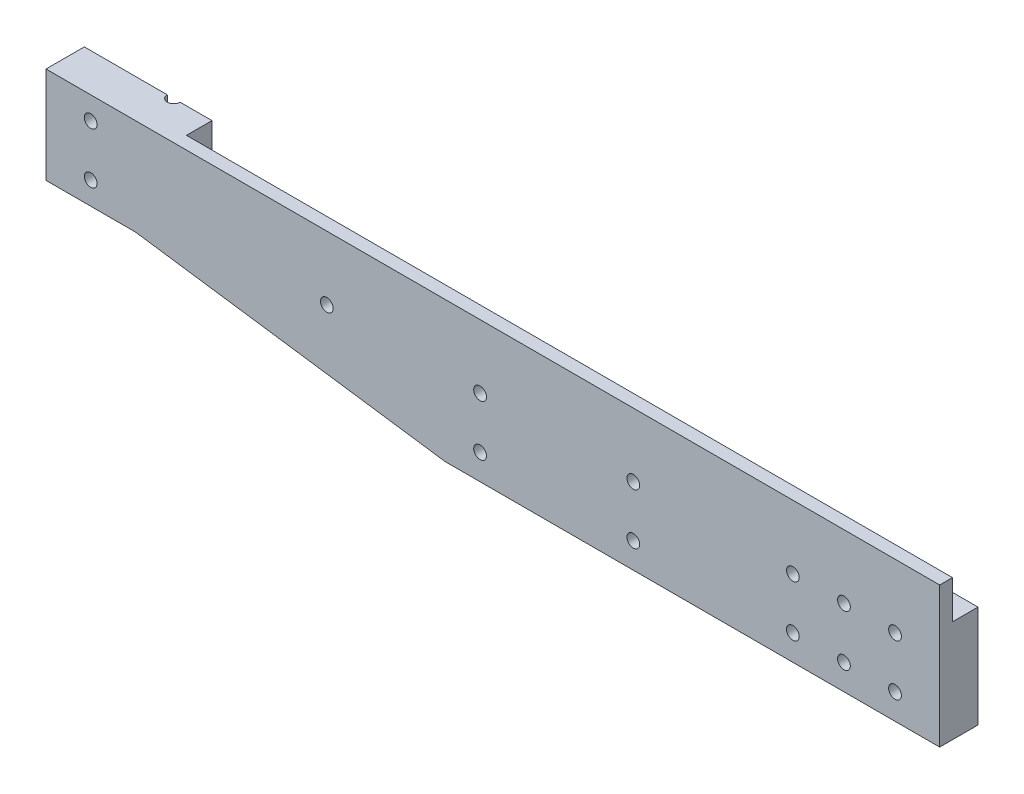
SolidWorks part; units mm, degrees
ref_plane "Front Plane" through (0, 0, 0) normal (0, 0, 1) x (1, 0, 0)
ref_plane "Top Plane" through (0, 0, 0) normal (0, 1, 0) x (1, 0, 0)
ref_plane "Right Plane" through (0, 0, 0) normal (1, 0, 0) x (0, 0, -1)
sketch "Sketch1" plane through (0, 0, 0) normal (0, 1, 0) x (1, 0, 0)
  line L0 (-25.4, 2.54) -> (-111.125, 2.54)
  line L1 (0, 0) -> (-25.4, 0)
  line L2 (0, 0) -> (0, 19.05)
  line L3 (0, 19.05) -> (-25.4, 19.05)
  line L4 (-25.4, 0) -> (-25.4, 2.54)
  line L5 (-111.125, 2.54) -> (-111.125, 0)
  line L6 (-111.125, 0) -> (-492.125, 0)
  line L7 (-25.4, 19.05) -> (-492.125, 19.05)
  line L8 (-492.125, 19.05) -> (-492.125, 0)
  line L9 (-111.125, 0) -> (-25.4, 0)
  dimension "D1" = 19.05
  dimension "D2" = 25.4
  dimension "D3" = 85.725
  dimension "D4" = 381
  dimension "D5" = 2.54
extrude "Boss-Extrude1" add sketch "Sketch1" along normal blind 69.85 contours L7 L8 L6 L5 L0 L4 | L4 L1 L2 L3 | L5 L9 L4 L0
sketch "Sketch2" plane through (0, 0, 0) normal (0, 0, 1) x (1, 0, 0)
  line L0 (-492.125, 34.925) -> (-246.0625, 0)
  line L2 (-492.125, 69.85) -> (-492.125, 0) construction
  line L4 (0, 0) -> (-492.125, 0) construction
extrude "Cut-Extrude1" cut sketch "Sketch2" against normal through all and the other way through all flip side to cut
sketch "Sketch3" plane through (0, 0, 0) normal (1, 0, 0) x (0, 0, -1)
  line L0 (6.35, 69.85) -> (6.35, 50.8)
  line L1 (19.05, 50.8) -> (19.05, 69.85)
  line L2 (19.05, 50.8) -> (6.35, 50.8)
  line L3 (19.05, 69.85) -> (6.35, 69.85)
extrude "Cut-Extrude2" cut sketch "Sketch3" against normal blind 381
sketch "Sketch4" plane through (0, 69.85, 0) normal (0, 1, 0) x (-1, 0, 0)
  line L1 (0, 0) -> (492.125, 0) construction
  line L2 (400.05, 0) -> (400.05, -19.05)
  dimension "D1" = 19.05
  dimension "D2" = 92.075
extrude "Cut-Extrude3" cut sketch "Sketch4" against normal through all and the other way through all
sketch "Sketch5" plane through (-400.05, 0, 0) normal (-1, 0, 0) x (0, 0, 1)
  line L1 (0, 21.8563) -> (-19.05, 21.8563)
  line L2 (0, 21.8563) -> (0, 69.85)
  line L3 (0, 69.85) -> (-19.05, 69.85)
  line L4 (-19.05, 21.8563) -> (-19.05, 69.85)
extrude "Boss-Extrude2" add sketch "Sketch5" along normal blind 44.45
sketch "Sketch7" plane through (0, 0, -19.05) normal (0, 0, -1) x (-1, 0, 0)
  line L0 (400.05, 21.8563) -> (400.05, 69.85)
  line L1 (381, 69.85) -> (444.5, 69.85) construction
sketch "Sketch8" plane through (0, 69.85, 0) normal (0, 1, 0) x (1, 0, 0)
  circle A0 centre (-400.05, 19.05) radius 3.175
  dimension "D1" = 6.35
extrude "Cut-Extrude5" cut sketch "Sketch8" against normal up to next
sketch "Sketch9" plane through (0, 0, 0) normal (0, 0, 1) x (1, 0, 0)
  line L0 (-47.625, 50.8) -> (-47.625, 0)
  line L1 (0, 0) -> (-95.25, 0)
  line L2 (0, 0) -> (0, 50.8)
  line L3 (0, 50.8) -> (-95.25, 50.8)
  line L4 (-95.25, 0) -> (-95.25, 50.8)
  line L5 (-73.025, 25.4) -> (-73.025, 38.1)
  line L6 (-47.625, 25.4) -> (-47.625, 38.1)
  line L7 (-47.625, 25.4) -> (-47.625, 12.7)
  line L8 (-47.625, 25.4) -> (-73.025, 25.4)
  line L9 (-47.625, 25.4) -> (-22.225, 25.4)
  line L10 (-73.025, 25.4) -> (-73.025, 12.7)
  line L11 (-22.225, 25.4) -> (-22.225, 38.1)
  line L12 (-22.225, 25.4) -> (-22.225, 12.7)
  line L13 (-95.25, 25.4) -> (-152.4, 25.4)
  line L14 (-152.4, 25.4) -> (-152.4, 38.1)
  line L15 (-152.4, 25.4) -> (-152.4, 12.7)
  line L16 (-152.4, 25.4) -> (-228.6, 25.4)
  line L17 (-228.6, 25.4) -> (-228.6, 38.1)
  line L18 (-228.6, 25.4) -> (-228.6, 12.7)
  line L19 (-228.6, 38.1) -> (-304.8, 38.1)
  circle A0 centre (-47.625, 38.1) radius 3.175
  circle A1 centre (-47.625, 12.7) radius 3.175
  circle A2 centre (-73.025, 38.1) radius 3.1496
  circle A3 centre (-73.025, 12.7) radius 3.175
  circle A4 centre (-22.225, 38.1) radius 3.175
  circle A5 centre (-22.225, 12.7) radius 3.175
  circle A6 centre (-152.4, 38.1) radius 3.175
  circle A7 centre (-152.4, 12.7) radius 3.175
  circle A8 centre (-228.6, 38.1) radius 3.175
  circle A9 centre (-228.6, 12.7) radius 3.175
  circle A10 centre (-304.8, 38.1) radius 3.175
  dimension "D3" = 25.4
  dimension "D5" = 12.7
  dimension "D7" = 6.35
  dimension "D8" = 6.35
  dimension "D11" = 6.2992
  dimension "D12" = 6.35
  dimension "D14" = 6.35
  dimension "D15" = 6.35
  dimension "D21" = 6.35
  dimension "D22" = 6.35
  dimension "D25" = 12.7
  dimension "D27" = 6.35
  dimension "D28" = 6.35
  dimension "D30" = 6.35
  dimension "D1" = 95.25
  dimension "D2" = 50.8
  dimension "D4" = 25.4
  dimension "D6" = 12.7
  dimension "D9" = 12.7
  dimension "D10" = 12.7
  dimension "D13" = 12.7
  dimension "D16" = 12.7
  dimension "D17" = 12.7
  dimension "D18" = 12.7
  dimension "D19" = 57.15
  dimension "D20" = 90
  dimension "D23" = 12.7
  dimension "D24" = 12.7
  dimension "D26" = 12.7
  dimension "D29" = 76.2
  dimension "D31" = 76.2
extrude "Cut-Extrude6" cut sketch "Sketch9" against normal up to next
sketch "Sketch11" plane through (0, 0, 0) normal (0, 0, 1) x (1, 0, 0)
  line L1 (-400.05, 21.8563) -> (-444.5, 21.8563)
  line L2 (-400.05, 21.8563) -> (-400.05, 69.85)
  line L3 (-400.05, 69.85) -> (-444.5, 69.85)
  line L4 (-444.5, 21.8563) -> (-444.5, 69.85)
  line L6 (-422.275, 45.8531) -> (-422.275, 58.5531)
  line L7 (-422.275, 45.8531) -> (-422.275, 33.1531)
  circle A0 centre (-422.275, 58.5531) radius 3.175
  circle A1 centre (-422.275, 33.1531) radius 3.175
  dimension "D1" = 12.7
  dimension "D3" = 6.35
  dimension "D4" = 6.35
  dimension "D2" = 12.7
  dimension "D5" = 22.225
  dimension "D6" = 11.2969
  dimension "D7" = 25.4
  dimension "D8" = 22.225
extrude "Cut-Extrude7" cut sketch "Sketch11" against normal up to next
